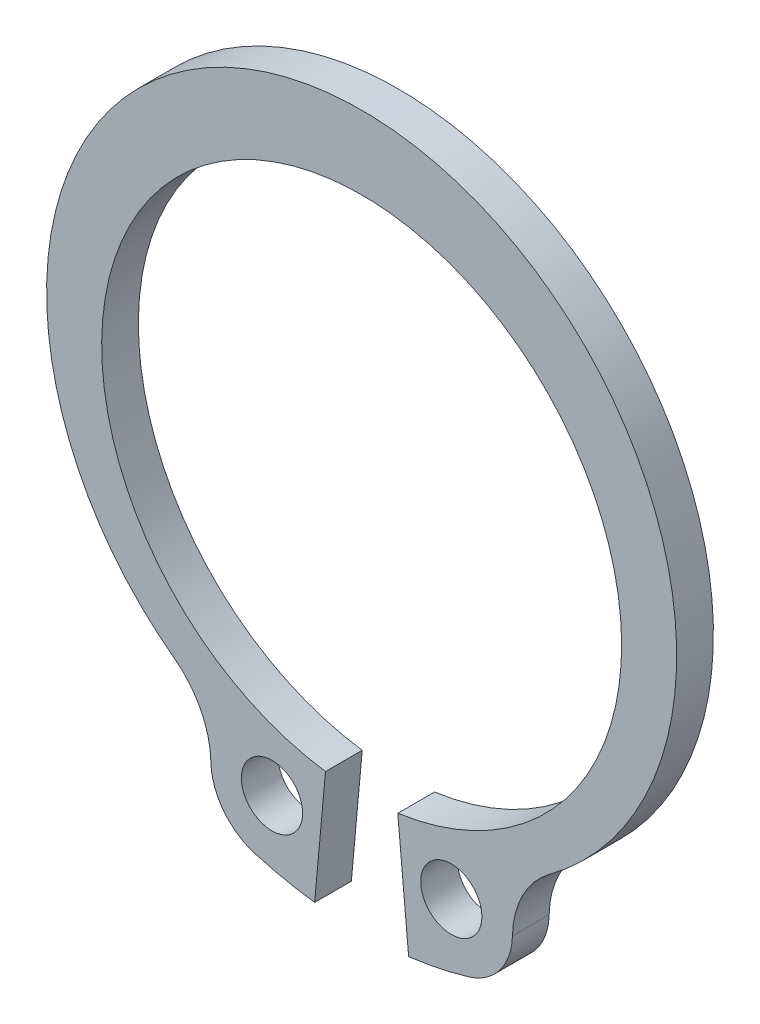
SolidWorks part; units mm, degrees
ref_plane "Face" through (0, 0, 0) normal (0, 0, 1) x (1, 0, 0)
ref_plane "Dessus" through (0, 0, 0) normal (0, 1, 0) x (1, 0, 0)
ref_plane "Droite" through (0, 0, 0) normal (1, 0, 0) x (0, 0, -1)
sketch "Esquisse1" plane through (0, 0, 0) normal (0, 0, 1) x (1, 0, 0)
  line L0 (0, 10.9) -> (0, 8.5) construction
  line L1 (1.1817, -8.4175) -> (1.536, -12.3013)
  line L2 (-1.1817, -8.4175) -> (-1.536, -12.3013)
  line L3 (0.4, -8.2403) -> (0.4, -12.1403) construction
  line L4 (-0.4, -8.2403) -> (-0.4, -12.1403) construction
  arc A0 (1.1817, -8.4175) -> (-1.1817, -8.4175) centre (0, 0) ccw
  arc A1 (6.1408, -7.6692) -> (-6.1408, -7.6692) centre (0, 0.6) ccw
  arc A2 (1.536, -12.3013) -> (3.4942, -11.8942) centre (0, 0) ccw
  circle A3 centre (2.9305, -9.9753) radius 1
  arc A4 (3.4942, -11.8942) -> (4.9301, -10.0163) centre (2.9305, -9.9753) ccw
  arc A5 (6.1408, -7.6692) -> (4.9301, -10.0163) centre (7.9294, -10.0777) ccw
  circle A6 centre (-2.9305, -9.9753) radius 1
  arc A7 (-6.1408, -7.6692) -> (-4.9301, -10.0163) centre (-7.9294, -10.0777) cw
  arc A8 (-3.4942, -11.8942) -> (-4.9301, -10.0163) centre (-2.9305, -9.9753) cw
  arc A9 (-1.536, -12.3013) -> (-3.4942, -11.8942) centre (0, 0) cw
  arc A10 (0.4, -8.2403) -> (-0.4, -8.2403) centre (0, 0) ccw construction
  circle A11 centre (0, 0) radius 9 construction
  dimension "dgorge" = 17
  dimension "D3" = 0.6
  dimension "dtrou" = 2
  dimension "D8" = 2
  dimension "D9" = 3
  dimension "dint" = 16.5
  dimension "dn" = 18
  dimension "b" = 2.4
  dimension "a" = 3.9
  dimension "D5" = 15.983
  dimension "D7" = 1.6
  dimension "D12" = 0.8
  dimension "D13" = 5.558
  dimension "D14" = 5.212
extrude "Base-Extrusion" add sketch "Esquisse1" along normal blind 1.2
equation "\"D3@Esquisse1\" = \"b@Esquisse1\"/4"
equation "\"D7@Esquisse1\"=\"dtrou@Esquisse1\"*0.8"
equation "\"D8@Esquisse1\" = \"dtrou@Esquisse1\""
equation "\"D9@Esquisse1\" = \"dtrou@Esquisse1\"*1.5"
equation "\"D12@Esquisse1\" = \"dtrou@Esquisse1\"*0.4"
equation "\"D5@Esquisse1\" = 360-(360-\"D13@Esquisse1\")*\"dint@Esquisse1\"/\"dgorge@Esquisse1\""
equation "\"D14@Esquisse1\" = (\"D5@Esquisse1\"-\"D13@Esquisse1\")/2"
